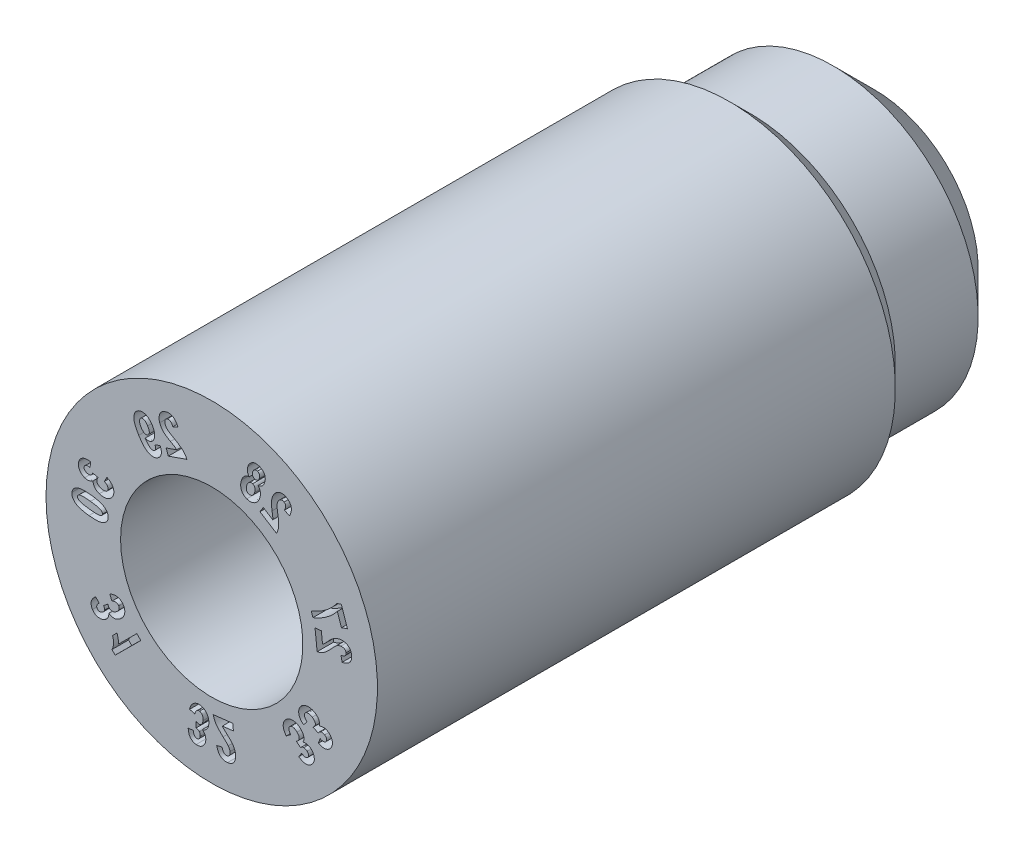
SolidWorks part; units mm, degrees
ref_plane "Front Plane" through (0, 0, 0) normal (0, 0, 1) x (1, 0, 0)
ref_plane "Top Plane" through (0, 0, 0) normal (0, 1, 0) x (1, 0, 0)
ref_plane "Right Plane" through (0, 0, 0) normal (1, 0, 0) x (0, 0, -1)
sketch "Sketch2" plane through (0, 0, 0) normal (0, 1, 0) x (1, 0, 0)
  line L0 (0, 4.8491) -> (0, -49995.1509) construction
  line L10 (1.2496, 8) -> (0.75, 8)
  line L11 (1.75, 7.4996) -> (1.2496, 8)
  line L12 (1.75, 6.5004) -> (1.75, 7.4996)
  line L13 (2, 6.2504) -> (1.75, 6.5004)
  line L14 (2, 0) -> (2, 6.2504)
  line L15 (1.1, 0) -> (2, 0)
  line L16 (1.1, 0) -> (1.1, 5.5)
  line L17 (0.75, 5.5) -> (1.1, 5.5)
  line L18 (0.75, 5.5) -> (0.75, 8)
  dimension "D1" = 4
  dimension "D2" = 2.2
  dimension "D3" = 2.5
  dimension "D4" = 1.5
  dimension "D5" = 3.5
  dimension "D6" = 8
  dimension "D7" = 45
  dimension "D8" = 45
  dimension "D9" = 1.4996
  dimension "D10" = 0.5004
revolve "Revolve1" add sketch "Sketch2" angle 360 about L0
sketch "Sketch9" plane through (0, 0, 0) normal (0, 0, 1) x (1, 0, 0)
  circle A30 centre (0, 0) radius 1.2734 construction
  text T0 "27    28    29    30    31    32    33" font "Arial Narrow" height 0.43
extrude "Cut-Extrude1" cut sketch "Sketch9" against normal blind 0.2
